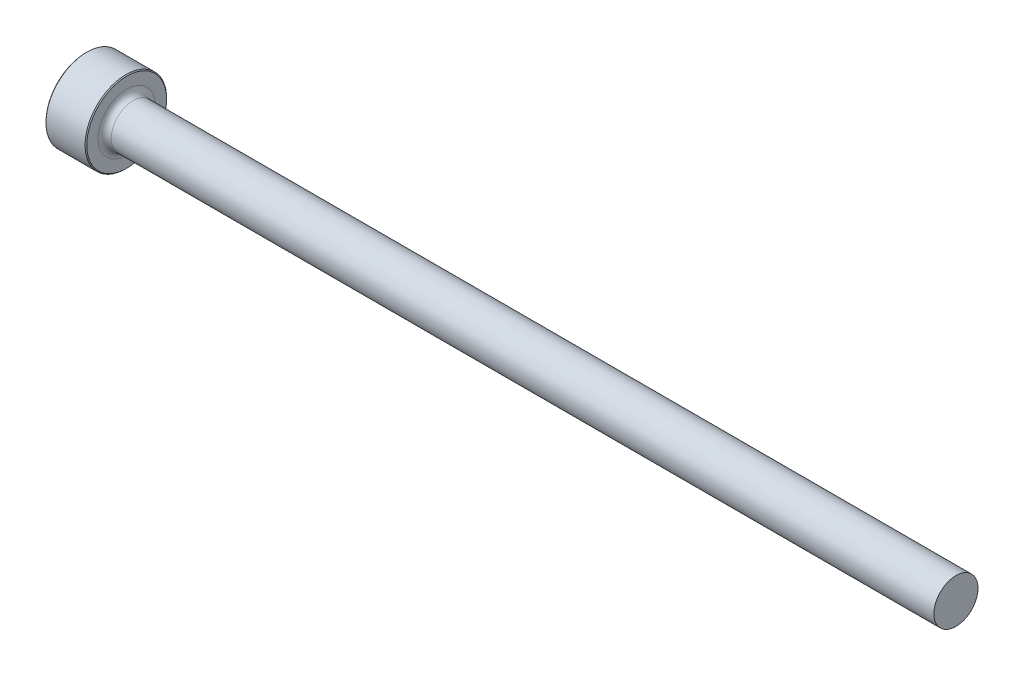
SolidWorks part; units mm, degrees
ref_plane "Front Plane" through (0, 0, 0) normal (0, 0, 1) x (1, 0, 0)
ref_plane "Top Plane" through (0, 0, 0) normal (0, 1, 0) x (1, 0, 0)
ref_plane "Right Plane" through (0, 0, 0) normal (1, 0, 0) x (0, 0, -1)
sketch "Sketch1" plane through (0, 0, 0) normal (0, 0, 1) x (1, 0, 0)
  line L0 (0, 0) -> (0, 4.7625)
  line L1 (0, 4.7625) -> (4.7625, 4.7625)
  line L2 (4.7625, 4.7625) -> (4.7625, 3.3379)
  line L3 (5.5245, 2.5759) -> (101.6, 2.5759)
  line L4 (101.6, 2.5759) -> (101.6, 0)
  line L5 (101.6, 0) -> (0, 0)
  line L6 (101.6, 0) -> (101.6, -2.5759) construction
  line L7 (101.6, -2.5759) -> (4.7625, -2.5759) construction
  line L8 (0, 0) -> (0, -4.7625) construction
  line L9 (0, -4.7625) -> (4.7625, -4.7625) construction
  line L10 (4.7625, -4.7625) -> (4.7625, -2.5759) construction
  arc A0 (4.7625, 3.3379) -> (5.5245, 2.5759) centre (5.5245, 3.3379) ccw
  dimension "D4" = 0.762
  dimension "L" = 101.6
  dimension "D" = 5.1518
  dimension "H" = 9.525
  dimension "T" = 4.7625
revolve "Revolve1" add sketch "Sketch1" angle 360 about L5
chamfer "Chamfer1" distance 0.1016 angle 45 2 edges at (0, 4.7625, 0) (4.7625, 4.7625, 0)
